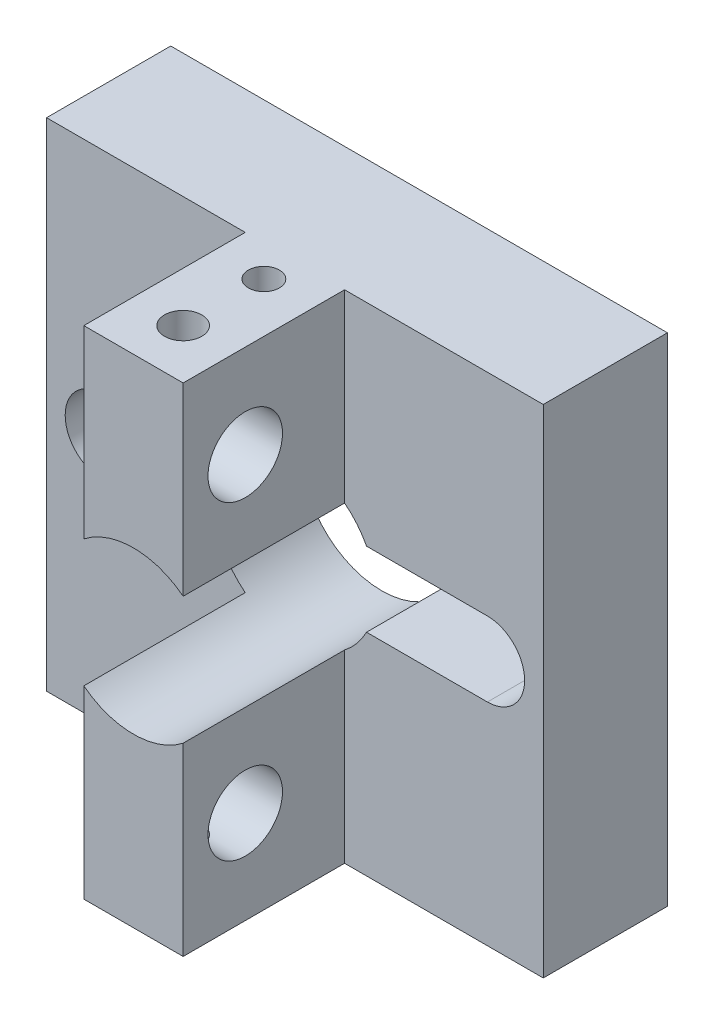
SolidWorks part; units mm, degrees
ref_plane "Plan1" through (0, 0, 0) normal (0, 0, 1) x (1, 0, 0)
ref_plane "Plan2" through (0, 0, 0) normal (0, 1, 0) x (1, 0, 0)
ref_plane "Plan3" through (0, 0, 0) normal (1, 0, 0) x (0, 0, -1)
sketch "Esquisse1" plane through (0, 0, 0) normal (0, 0, 1) x (1, 0, 0)
  line L0 (0, 0) -> (40, 0)
  line L1 (0, 0) -> (0, 40)
  line L2 (40, 40) -> (0, 40)
  line L3 (40, 40) -> (40, 0)
  dimension "D1" = 40
  dimension "D2" = 40
extrude "brut" add sketch "Esquisse1" along normal blind 10
sketch "Esquisse2" plane through (0, 0, 10) normal (0, 0, 1) x (1, 0, 0)
  line L0 (16, 0) -> (24, 0)
  line L1 (16, 0) -> (16, 40)
  line L2 (24, 40) -> (16, 40)
  line L3 (24, 40) -> (24, 0)
  line L4 (0, 0) -> (40, 0) construction
  line L5 (0, 0) -> (0, 40) construction
  dimension "D1" = 8
  dimension "D2" = 16
  dimension "D3" = 40
extrude "épaulement" add sketch "Esquisse2" along normal blind 13
sketch "Esquisse3" plane through (0, 0, 23) normal (0, 0, 1) x (1, 0, 0)
  line L0 (0, 0) -> (0, 40) construction
  line L1 (4.5, 23) -> (35.5, 23)
  line L2 (4.5, 17) -> (35.5, 17)
  line L3 (24, 0) -> (40, 0) construction
  arc A0 (4.5, 23) -> (4.5, 17) centre (4.5, 20) ccw
  arc A1 (35.5, 17) -> (35.5, 23) centre (35.5, 20) ccw
  dimension "D1" = 6
  dimension "D2" = 6
  dimension "D3" = 4.5
  dimension "D4" = 31
  dimension "D5" = 20
extrude "trou oblong" cut sketch "Esquisse3" against normal blind 20
sketch "Esquisse4" plane through (0, 0, 0) normal (0, 0, -1) x (-1, 0, 0)
  line L0 (0, 0) -> (-40, 0) construction
  line L1 (-40, 40) -> (-40, 0) construction
  circle A0 centre (-20, 20) radius 14
  dimension "D1" = 28
  dimension "D2" = 20
  dimension "D3" = 20
extrude "alèsage" cut sketch "Esquisse4" against normal blind 3
sketch "Esquisse5" plane through (0, 0, 23) normal (0, 0, 1) x (1, 0, 0)
  circle A0 centre (20, 20) radius 6.5
  dimension "D1" = 13
extrude "perçage" cut sketch "Esquisse5" against normal through all
sketch "Esquisse6" plane through (24, 0, 0) normal (1, 0, 0) x (0, 0, -1)
  line L0 (-23, 40) -> (-23, 25.1235) construction
  line L1 (-23, 40) -> (-10, 40) construction
  circle A0 centre (-18, 32.5) radius 3
  dimension "D1" = 6
  dimension "D2" = 5
  dimension "D3" = 7.5
extrude "perçage 1" cut sketch "Esquisse6" against normal through all
pattern_linear "2ème perçage" count 2 spacing 25
hole_wizard "Perç taraud 22" positions "Esquisse9" profile "Esquisse8" legacy
sketch "Esquisse9" plane through (0, 40, 0) normal (0, 1, 0) x (-1, 0, 0)
  line L0 (-40, 0) -> (0, 0) construction
  line L1 (0, 10) -> (0, 0) construction
  point P0 (-20, 19)
  dimension "D1" = 19
  dimension "D2" = 20
sketch "Esquisse8" plane through (20, 40, 19) normal (1, 0, 0) x (0, 0, 1)
  line L0 (0, 0) -> (0, 7.5)
  line L1 (0, 7.5) -> (1.5, 7.5)
  line L2 (1.5, 7.5) -> (1.5, 0)
  line L3 (1.5, 0) -> (0, 0)
  line L4 (0, 110) -> (0, -10) construction
  dimension "Diamètre" = 3
  dimension "Profondeur" = 7.5
hole_wizard "2ème perç+taraud" positions "Esquisse11" profile "Esquisse10" legacy
sketch "Esquisse11" plane through (0, 0, 0) normal (0, -1, 0) x (1, 0, 0)
  line L0 (20, 3) -> (20, 0) construction
  line L1 (0, 0) -> (40, 0) construction
  point P0 (20, 19)
  dimension "D1" = 19
sketch "Esquisse10" plane through (20, 0, 19) normal (1, 0, 0) x (0, 0, -1)
  line L0 (0, 0) -> (0, 7.5)
  line L1 (0, 7.5) -> (1.5, 7.5)
  line L2 (1.5, 7.5) -> (1.5, 0)
  line L3 (1.5, 0) -> (0, 0)
  line L4 (0, 110) -> (0, -10) construction
  dimension "Diamètre" = 3
  dimension "Profondeur" = 7.5
hole_wizard "Perçage 21" positions "Esquisse14" profile "Esquisse13" legacy
sketch "Esquisse14" plane through (0, 40, 0) normal (0, 1, 0) x (-1, 0, 0)
  line L0 (-20, 3) -> (-20, 0) construction
  line L1 (-40, 0) -> (0, 0) construction
  point P0 (-20, 12.5)
  dimension "D1" = 12.5
sketch "Esquisse13" plane through (20, 40, 12.5) normal (1, 0, 0) x (0, 0, 1)
  line L0 (0, 0) -> (0, 10.2511)
  line L1 (0, 10.2511) -> (1.25, 9.5)
  line L2 (1.25, 9.5) -> (1.25, 0)
  line L4 (1.25, 0) -> (0, 0)
  line L6 (0, 10.2511) -> (-1.25, 9.5) construction
  line L7 (0, -4.2442) -> (0, 117.3081) construction
  dimension "Diamètre" = 2.5
  dimension "Profondeur" = 9.5
  dimension "Angle" = 118
hole_wizard "2ème perç " positions "Esquisse16" profile "Esquisse15" legacy
sketch "Esquisse16" plane through (0, 0, 0) normal (0, -1, 0) x (1, 0, 0)
  line L0 (0, 10) -> (0, 0) construction
  line L1 (0, 0) -> (40, 0) construction
  point P0 (20, 12.5)
  dimension "D1" = 20
  dimension "D2" = 12.5
sketch "Esquisse15" plane through (20, 0, 12.5) normal (1, 0, 0) x (0, 0, -1)
  line L0 (0, 0) -> (0, 10.2511)
  line L1 (0, 10.2511) -> (1.25, 9.5)
  line L2 (1.25, 9.5) -> (1.25, 0)
  line L4 (1.25, 0) -> (0, 0)
  line L6 (0, 10.2511) -> (-1.25, 9.5) construction
  line L7 (0, -4.2442) -> (0, 117.3081) construction
  dimension "Diamètre" = 2.5
  dimension "Profondeur" = 9.5
  dimension "Angle" = 118
